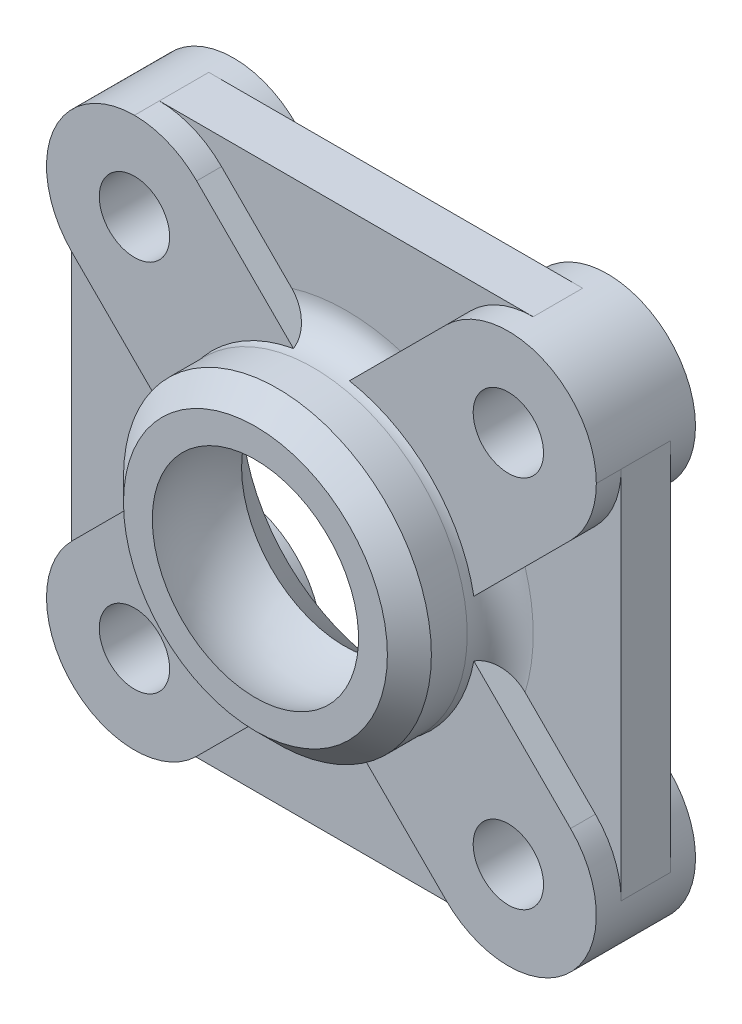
SolidWorks part; units mm, degrees
ref_plane "Plan de face" through (0, 0, 0) normal (0, 0, 1) x (1, 0, 0)
ref_plane "Plan de dessus" through (0, 0, 0) normal (0, 1, 0) x (1, 0, 0)
ref_plane "Plan de droite" through (0, 0, 0) normal (1, 0, 0) x (0, 0, -1)
sketch "Esquisse1" plane through (0, 0, 0) normal (0, 0, 1) x (1, 0, 0)
  line L1 (-8.5, 12.5) -> (8.5, 12.5)
  line L2 (-12.5, 8.5) -> (-12.5, -8.5)
  line L3 (-8.5, -12.5) -> (8.5, -12.5)
  line L4 (12.5, 8.5) -> (12.5, -8.5)
  arc A0 (-12.5, -8.5) -> (-8.5, -12.5) centre (-8.5, -8.5) ccw
  arc A1 (8.5, -12.5) -> (12.5, -8.5) centre (8.5, -8.5) ccw
  arc A2 (8.5, 12.5) -> (12.5, 8.5) centre (8.5, 8.5) cw
  arc A3 (-8.5, 12.5) -> (-12.5, 8.5) centre (-8.5, 8.5) ccw
  circle A4 centre (-8.5, 8.5) radius 1.6
  circle A5 centre (8.5, 8.5) radius 1.6
  circle A6 centre (-8.5, -8.5) radius 1.6
  circle A7 centre (8.5, -8.5) radius 1.6
  dimension "D5" = 4
  dimension "D6" = 3.2
  dimension "D7" = 3.2
  dimension "D8" = 3.2
  dimension "D9" = 3.2
  dimension "D1" = 25
  dimension "D2" = 25
  dimension "D3" = 12.5
  dimension "D4" = 12.5
extrude "Boss.-Extru.1" add sketch "Esquisse1" along normal blind 2.25
sketch "Esquisse2" plane through (0, 0, 2.25) normal (0, 0, 1) x (1, 0, 0)
  circle A0 centre (0, 0) radius 7
  dimension "D1" = 14
extrude "Boss.-Extru.2" add sketch "Esquisse2" along normal blind 4.13
chamfer "Chanfrein1" distance 1 angle 45 1 edges at (7, 0, 6.38)
sketch "Esquisse3" plane through (0, 0, 0) normal (0, 1, 0) x (1, 0, 0)
  line L0 (0, -5.38) -> (0, -2.25) construction
  line L1 (0, 7.2262) -> (0, -14.2132) construction
  line L2 (-6, -6.38) -> (6, -6.38) construction
  line L3 (0, -6.38) -> (-4.6895, -6.38)
  line L5 (-6, -6.38) -> (6, -6.38) construction
  line L6 (-7.0095, 0) -> (0, 0)
  line L7 (-4.6895, -2.32) -> (-7.0095, 0)
  line L8 (-8.5, 0) -> (8.5, 0) construction
  line L9 (-8.5, 0) -> (-12.5, 0) construction
  line L10 (0, -6.38) -> (0, 0)
  arc A0 (-4.6895, -2.32) -> (-4.6895, -6.38) centre (0, -4.35) ccw
  dimension "D1" = 10.22
  dimension "D2" = 2.03
  dimension "D3" = 2.03
  dimension "D4" = 45
revolve "Enlèvement de matière-Révolution2" cut sketch "Esquisse3" angle 360 about L1
sketch "Esquisse6" plane through (0, 0, 0) normal (0, 0, -1) x (-1, 0, 0)
  arc A2 (8.5, -12.5) -> (12.5, -8.5) centre (8.5, -8.5) ccw construction
  circle A3 centre (8.5, -8.5) radius 4
  circle A4 centre (8.5, -8.5) radius 1.6 construction
  circle A5 centre (8.5, -8.5) radius 1.6
extrude "Boss.-Extru.3" add sketch "Esquisse6" along normal blind 1.13
pattern_circular "Répétition circulaire1" count 4 every 90 about axis through (0, 0, 0) along (0, 0, 1) of "Boss.-Extru.3"
sketch "Esquisse8" plane through (0, 0, 2.25) normal (0, 0, 1) x (1, 0, 0)
  line L0 (-11.3284, -5.6716) -> (-6.8904, -1.2336)
  line L1 (-5.6716, -11.3284) -> (-1.2336, -6.8904)
  line L6 (-8.5, -12.5) -> (8.5, -12.5) construction
  circle A0 centre (0, 0) radius 7 construction
  circle A1 centre (-8.5, -8.5) radius 1.6
  circle A2 centre (-8.5, -8.5) radius 1.6
  arc A3 (-6.8904, -1.2336) -> (-1.2336, -6.8904) centre (0, 0) ccw
  arc A5 (-12.5, -8.5) -> (-8.5, -12.5) centre (-8.5, -8.5) ccw construction
  arc A8 (-11.3284, -5.6716) -> (-5.6716, -11.3284) centre (-8.5, -8.5) ccw
  dimension "D2" = 45
  dimension "D1" = 0
extrude "Boss.-Extru.4" add sketch "Esquisse8" along normal blind 1.13
pattern_circular "Répétition circulaire2" count 4 every 90 about axis through (0, 0, 0) along (0, 0, 1) of "Boss.-Extru.4"
sketch "Esquisse10" plane through (0, 0, 0) normal (1, 0, 0) x (0, 0, -1)
  line L3 (-2.25, 7) -> (-2.25, 8.5)
  line L4 (-3.75, 7) -> (-2.25, 7)
  line L6 (-2.25, 8.5) -> (-2.25, 5.6716) construction
  line L7 (-5.38, 0) -> (-2.25, 0) construction
  arc A0 (-2.25, 8.5) -> (-3.75, 7) centre (-3.75, 8.5) cw
  dimension "D1" = 1.5
  dimension "D2" = 7
revolve "Révolution1" add sketch "Esquisse10" angle 360 about axis through (0, 0, 6.38) along (0, 0, -1)
ref_point "centre embase"
